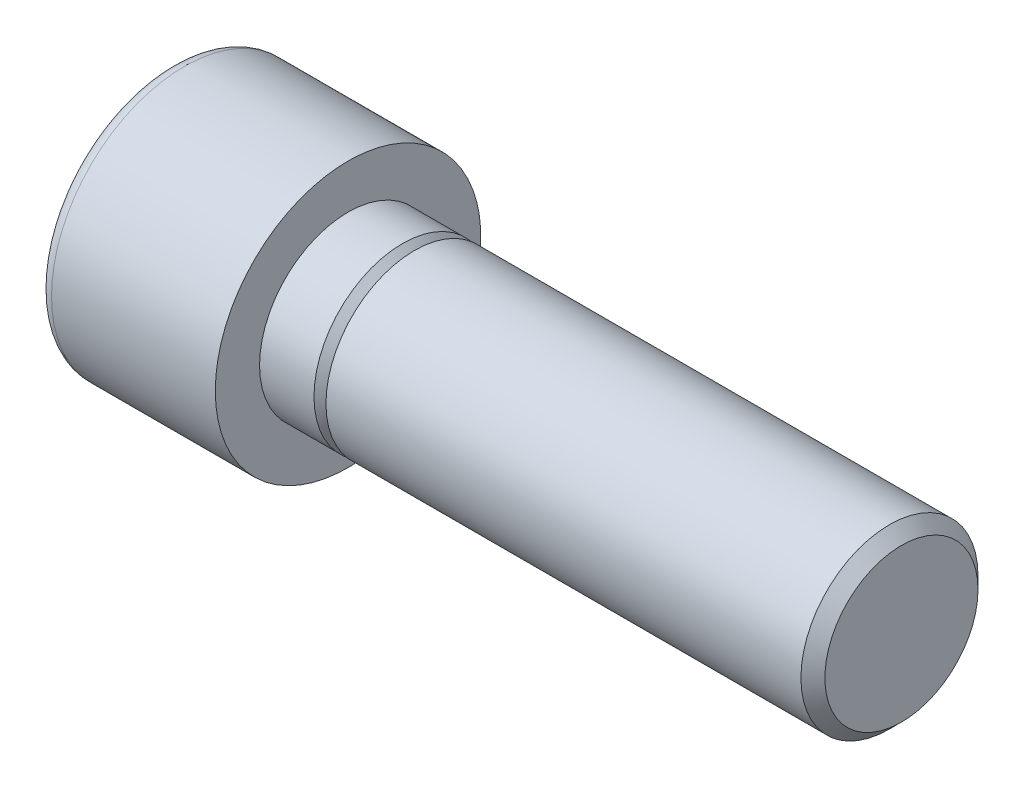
SolidWorks part; units mm, degrees
ref_plane "Plan de face" through (0, 0, 0) normal (0, 0, 1) x (1, 0, 0)
ref_plane "Plan de dessus" through (0, 0, 0) normal (0, 1, 0) x (1, 0, 0)
ref_plane "Plan de droite" through (0, 0, 0) normal (1, 0, 0) x (0, 0, -1)
ref_plane "Plan1" through (0, 0, 0) normal (0, 0, -1) x (-1, 0, 0)
sketch "Esquisse1" plane through (0, 0, 0) normal (0, 0, -1) x (-1, 0, 0)
  line L0 (-80, 8) -> (-80, 0)
  line L1 (-80, 0) -> (-14, 0)
  line L2 (-14, 0) -> (-14, 12)
  line L3 (-14, 12) -> (-30, 12)
  line L4 (-30, 12) -> (-30, 8)
  line L5 (-30, 8) -> (-34.9175, 8)
  line L6 (-34.9175, 8) -> (-36, 6.9175)
  line L7 (-36, 6.9175) -> (-36, 8)
  line L8 (-36, 8) -> (-80, 8)
  line L9 (-80, 0) -> (-14, 0) construction
  dimension "D1" = 16
  dimension "D2" = 44
  dimension "D3" = 135
  dimension "D4" = 50
revolve "Révolution1" add sketch "Esquisse1" angle 360 about L9
sketch "Esquisse2" plane through (14, 0, 0) normal (-1, 0, 0) x (0, 0, 1)
  line L0 (-7, -4.0415) -> (0, -8.0829)
  line L1 (0, -8.0829) -> (7, -4.0415)
  line L2 (7, -4.0415) -> (7, 4.0415)
  line L3 (7, 4.0415) -> (0, 8.0829)
  line L4 (0, 8.0829) -> (-7, 4.0415)
  line L5 (-7, 4.0415) -> (-7, -4.0415)
extrude "Enlèv. mat.-Extru.1" cut sketch "Esquisse2" against normal blind 8
chamfer "Chanfrein1" distance 1.0825 angle 45 1 edges at (80, 0, 8)
fillet "Congé1" radius 1.2 1 edges at (14, 0, 12)
